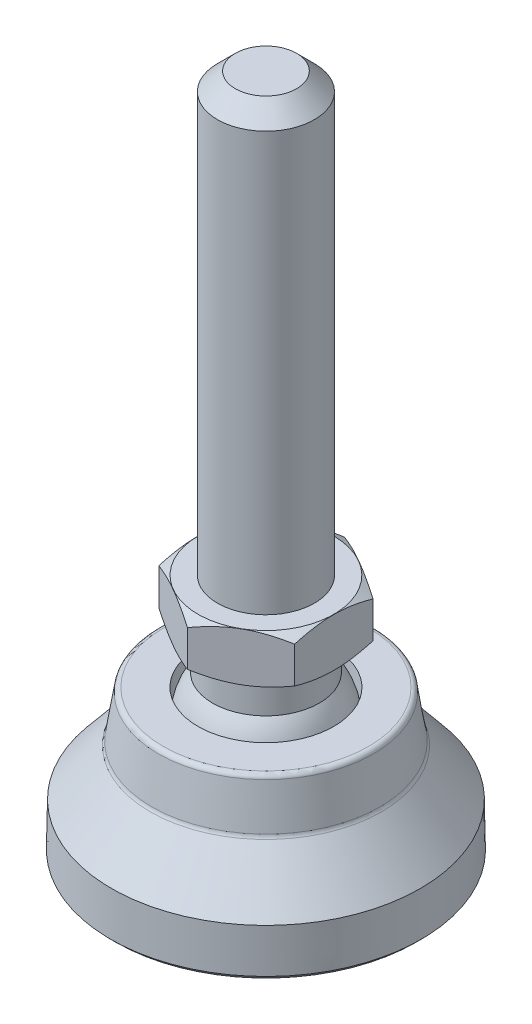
SolidWorks part; units mm, degrees
ref_plane "Piano frontale" through (0, 0, 0) normal (0, 0, 1) x (1, 0, 0)
ref_plane "Piano superiore" through (0, 0, 0) normal (0, 1, 0) x (1, 0, 0)
ref_plane "Piano destro" through (0, 0, 0) normal (1, 0, 0) x (0, 0, -1)
imported_body "342221_01-1-solid1"
imported_body "342221_02-1-solid1"
other "Sposta faccia1" parameters "D1"=2
